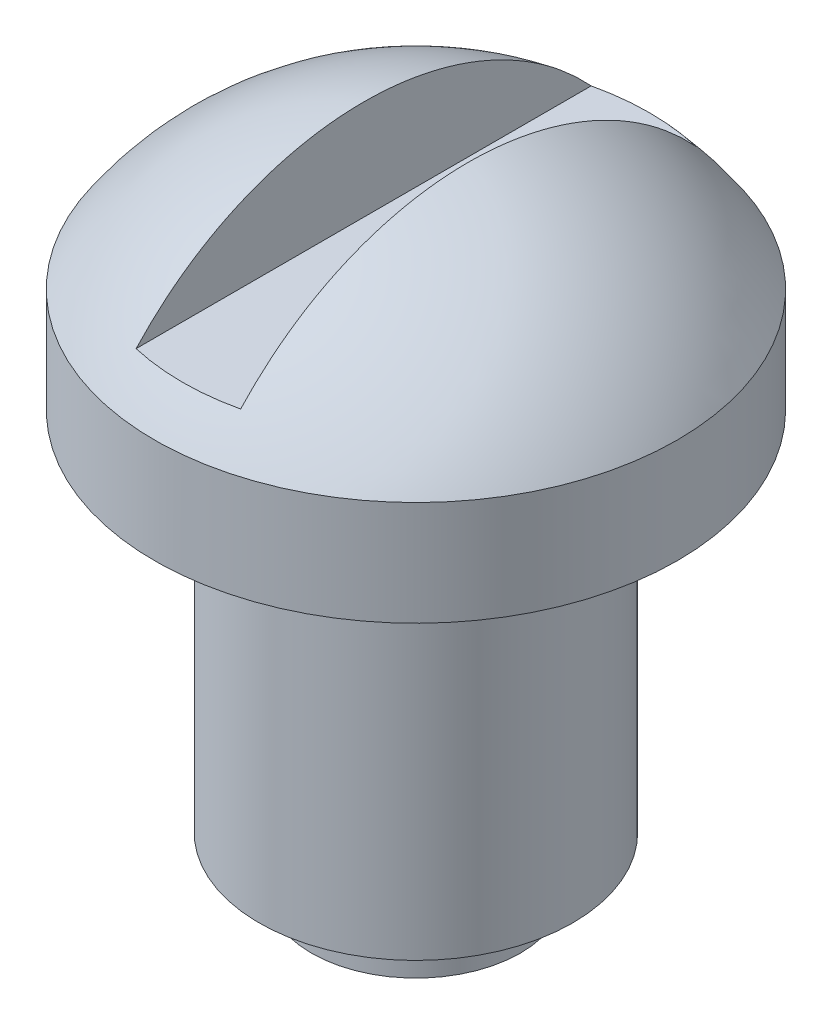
SolidWorks part; units mm, degrees
ref_plane "Front Plane" through (0, 0, 0) normal (0, 0, 1) x (1, 0, 0)
ref_plane "Top Plane" through (0, 0, 0) normal (0, 1, 0) x (1, 0, 0)
ref_plane "Right Plane" through (0, 0, 0) normal (1, 0, 0) x (0, 0, -1)
ref_plane "Plane1" through (0, 12.69, 0) normal (0, 1, 0) x (-1, 0, 0)
sketch "Sketch1" plane through (0, 0, 0) normal (0, 0, 1) x (1, 0, 0)
  line L0 (0, 0) -> (0, 12.6834) construction
  line L1 (0, 0) -> (-2, 0)
  line L2 (-2, 0) -> (-2, 1)
  line L3 (-2, 1) -> (-3, 1)
  line L4 (-3, 1) -> (-3, 8)
  line L5 (-3, 8) -> (-5, 8)
  line L6 (-5, 8) -> (-5, 10)
  line L7 (0, 12.6834) -> (0, 0)
  arc A0 (-5, 10) -> (0, 12.6834) centre (0, 6.6834) cw
  dimension "D7" = 6
  dimension "D1" = 10
  dimension "D2" = 4
  dimension "D3" = 6
  dimension "D4" = 1
  dimension "D5" = 7
  dimension "D6" = 2
revolve "Revolve1" add sketch "Sketch1" angle 360 about L0
sketch "Sketch2" plane through (0, 12.69, 0) normal (0, 1, 0) x (-1, 0, 0)
  line L1 (-1, 5.35) -> (1, 5.35)
  line L2 (-1, 5.35) -> (-1, -5.35)
  line L3 (-1, -5.35) -> (1, -5.35)
  line L4 (1, 5.35) -> (1, -5.35)
  point P4 (0, 5.35)
  point P6 (-1, 0)
  dimension "D1" = 2
extrude "Extrude1" cut sketch "Sketch2" against normal blind 2
